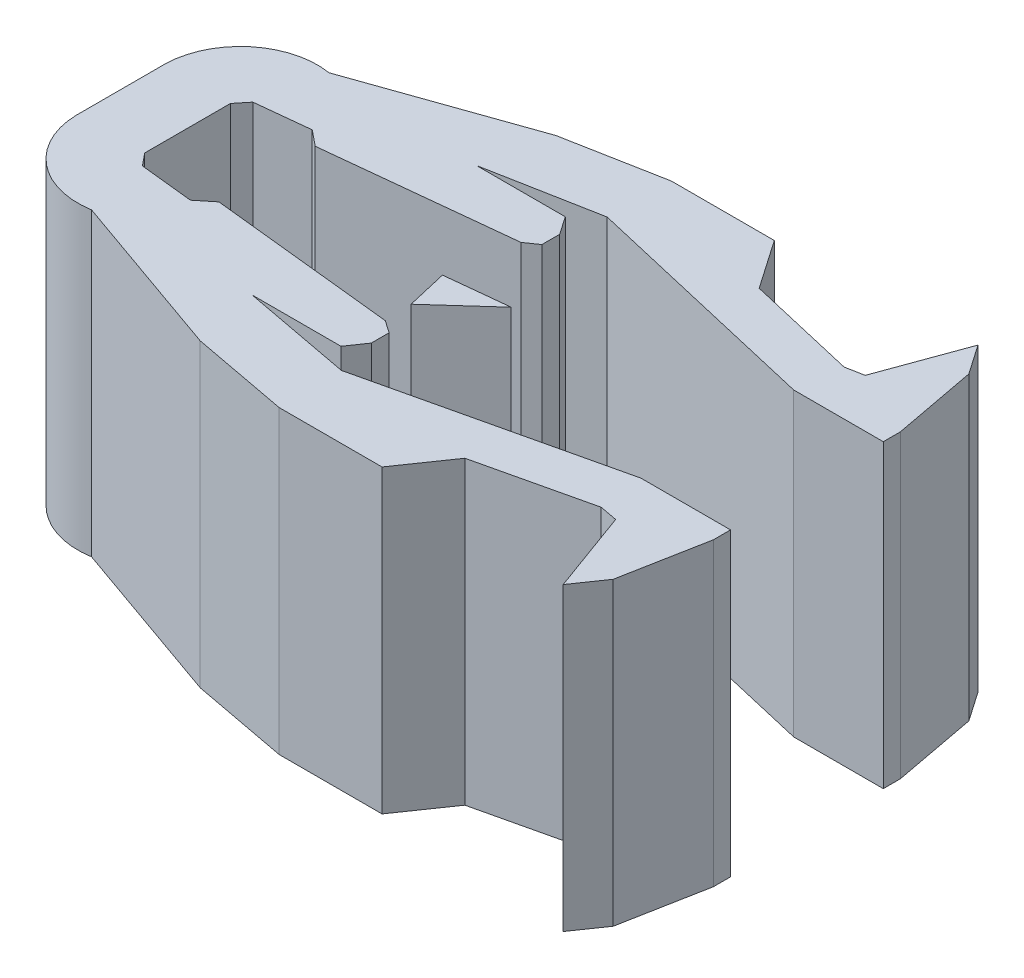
SolidWorks part; units mm, degrees
ref_plane "Front Plane" through (0, 0, 0) normal (0, 0, 1) x (1, 0, 0)
ref_plane "Top Plane" through (0, 0, 0) normal (0, 1, 0) x (1, 0, 0)
ref_plane "Right Plane" through (0, 0, 0) normal (1, 0, 0) x (0, 0, -1)
sketch "Sketch1" plane through (0, 0, 0) normal (0, 1, 0) x (1, 0, 0)
  line L0 (0, 0) -> (17.26, 0) construction
  line L1 (105.5363, 228.9253) -> (539.5363, 228.9253) construction
  line L2 (0, -1.1206) -> (0, 1.1206)
  line L3 (2.236, 2.9633) -> (6.4227, 4.438)
  line L4 (6.4227, 4.438) -> (8.8502, 4.8954)
  line L5 (8.8502, 4.8954) -> (11.4183, 4.8954)
  line L6 (11.4183, 4.8954) -> (12.2627, 3.6729)
  line L7 (12.2627, 3.6729) -> (15.0243, 3.0308)
  line L8 (15.0243, 3.0308) -> (15.4682, 3.1144)
  line L9 (15.4682, 3.1144) -> (16.2204, 5.1768)
  line L10 (16.2204, 5.1768) -> (16.7307, 4.438)
  line L11 (16.7307, 4.438) -> (17.1273, 2.3329)
  line L12 (17.1273, 2.3329) -> (17.1273, 1.9062)
  line L13 (17.1273, 1.9062) -> (16.6083, 1.9062)
  line L14 (16.6083, 1.9062) -> (14.8912, 1.9062)
  line L15 (14.8912, 1.9062) -> (8.8253, 3.3164)
  line L16 (8.8253, 3.3164) -> (6.079, 2.799)
  line L17 (6.079, 2.799) -> (8.2969, 2.799)
  line L18 (8.2969, 2.799) -> (8.6059, 2.3516)
  line L19 (8.6059, 2.3516) -> (8.6059, 1.9062)
  line L20 (8.6059, 1.9062) -> (8.2969, 1.6928)
  line L21 (8.2969, 1.6928) -> (3.6531, 1.2026)
  line L22 (3.6531, 1.2026) -> (3.2603, 1.5203)
  line L23 (3.2603, 1.5203) -> (1.9199, 1.3788)
  line L24 (1.9199, 1.3788) -> (1.6692, 1.0689)
  line L25 (1.6692, 1.0689) -> (1.6692, -1.0689)
  line L26 (1.9199, -1.3788) -> (1.6692, -1.0689)
  line L27 (3.2603, -1.5203) -> (1.9199, -1.3788)
  line L28 (3.6531, -1.2026) -> (3.2603, -1.5203)
  line L29 (8.2969, -1.6928) -> (3.6531, -1.2026)
  line L30 (8.6059, -1.9062) -> (8.2969, -1.6928)
  line L31 (8.6059, -2.3516) -> (8.6059, -1.9062)
  line L32 (8.2969, -2.799) -> (8.6059, -2.3516)
  line L33 (6.079, -2.799) -> (8.2969, -2.799)
  line L34 (8.8253, -3.3164) -> (6.079, -2.799)
  line L35 (14.8912, -1.9062) -> (8.8253, -3.3164)
  line L36 (16.6083, -1.9062) -> (14.8912, -1.9062)
  line L37 (17.1273, -1.9062) -> (16.6083, -1.9062)
  line L38 (17.1273, -2.3329) -> (17.1273, -1.9062)
  line L39 (16.7307, -4.438) -> (17.1273, -2.3329)
  line L40 (16.2204, -5.1768) -> (16.7307, -4.438)
  line L41 (15.4682, -3.1144) -> (16.2204, -5.1768)
  line L42 (15.0243, -3.0308) -> (15.4682, -3.1144)
  line L43 (12.2627, -3.6729) -> (15.0243, -3.0308)
  line L44 (11.4183, -4.8954) -> (12.2627, -3.6729)
  line L45 (8.8502, -4.8954) -> (11.4183, -4.8954)
  line L46 (6.4227, -4.438) -> (8.8502, -4.8954)
  line L47 (2.236, -2.9633) -> (6.4227, -4.438)
  arc A0 (2.236, 2.9633) -> (0, 1.1206) centre (1.9199, 1.0689) ccw
  arc A1 (2.236, -2.9633) -> (0, -1.1206) centre (1.9199, -1.0689) cw
  point P32 (1.6692, 1.3788)
  point P33 (1.9199, 1.0689)
  point P37 (1.6692, 0)
  dimension "D1" = 17.26
extrude "Boss-Extrude1" add sketch "Sketch1" along normal blind 7.5
sketch "Sketch2" plane through (0, 0, 0) normal (0, 1, 0) x (1, 0, 0)
  line L0 (0, 0) -> (17.26, 0) construction
  line L1 (105.5363, 228.9253) -> (539.5363, 228.9253) construction
  line L2 (8.0765, 1.6695) -> (6.5256, 1.5058)
  line L3 (3.6531, 1.2026) -> (8.2969, 1.6928) construction
  line L4 (6.5256, 1.5058) -> (6.7623, 0.4854)
  line L5 (6.7623, 0.4854) -> (8.0765, 1.6695)
  line L6 (8.0765, 1.6695) -> (8.0819, 1.6426)
  line L7 (6.7623, -0.4854) -> (8.0765, -1.6695)
  line L8 (6.5256, -1.5058) -> (6.7623, -0.4854)
  line L9 (8.0765, -1.6695) -> (6.5256, -1.5058)
  line L10 (8.0765, -1.6695) -> (8.0819, -1.6426)
  point P15 (0, 0)
  point P16 (0, 0)
  dimension "D1" = 17.26
extrude "Boss-Extrude2" add sketch "Sketch2" along normal blind 4.5 from offset 1.5 contours L4 L5 L2 | L9 L7 L8
